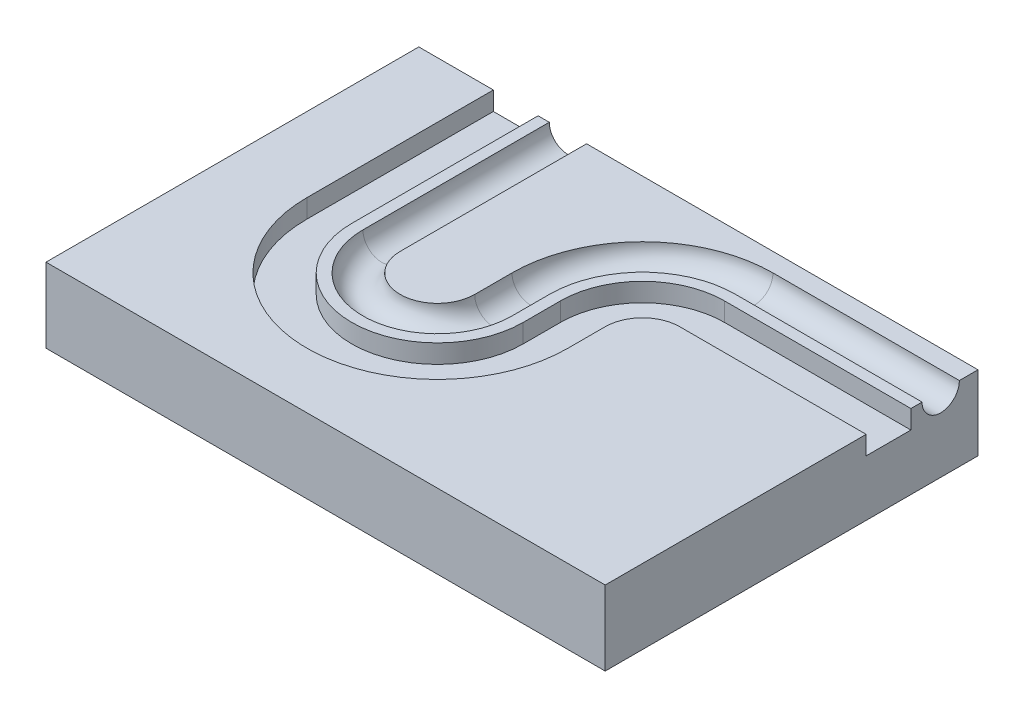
SolidWorks part; units mm, degrees
ref_plane "Front Plane" through (0, 0, 0) normal (0, 0, 1) x (1, 0, 0)
ref_plane "Top Plane" through (0, 0, 0) normal (0, 1, 0) x (1, 0, 0)
ref_plane "Right Plane" through (0, 0, 0) normal (1, 0, 0) x (0, 0, -1)
sketch "Sketch1" plane through (0, 0, 0) normal (0, 1, 0) x (1, 0, 0)
  line L1 (0, 100) -> (150, 100)
  line L2 (0, 100) -> (0, 0)
  line L3 (0, 0) -> (150, 0)
  line L4 (150, 100) -> (150, 0)
  dimension "D1" = 150
  dimension "D2" = 100
extrude "Extrude1" add sketch "Sketch1" along normal mid plane 20
sketch "Sketch2" plane through (0, 10, 0) normal (0, 1, 0) x (-1, 0, 0)
  line L0 (-150, -70) -> (-100, -70)
  line L1 (-150, 0) -> (-150, -100) construction
  line L2 (-90, -60) -> (-90, -50)
  line L3 (-20, -50) -> (-20, -100)
  line L4 (-150, -100) -> (0, -100) construction
  line L5 (0, -100) -> (0, 0) construction
  arc A0 (-100, -70) -> (-90, -60) centre (-100, -60) ccw
  arc A1 (-90, -50) -> (-20, -50) centre (-55, -50) cw
  dimension "D1" = 35
  dimension "D4" = 10
  dimension "D2" = 20
  dimension "D3" = 30
  dimension "D5" = 50
sketch "Sketch3" plane through (150, 0, 0) normal (1, 0, 0) x (0, 0, -1)
  line L1 (50, 10) -> (100, 10) construction
  line L4 (70, 10) -> (82, 10)
  line L5 (70, 10) -> (70, 5)
  line L6 (70, 5) -> (82, 5)
  line L7 (82, 10) -> (82, 5)
  line L8 (70, 10) -> (60, 10) construction
  line L9 (100, 10) -> (100, -10) construction
  circle A0 centre (90, 10) radius 5
  dimension "D2" = 12
  dimension "D5" = 10
  dimension "D1" = 5
  dimension "D3" = 18
  dimension "D4" = 10
sweep "Cut-Sweep1" cut profiles "Sketch3" path "Sketch2"
